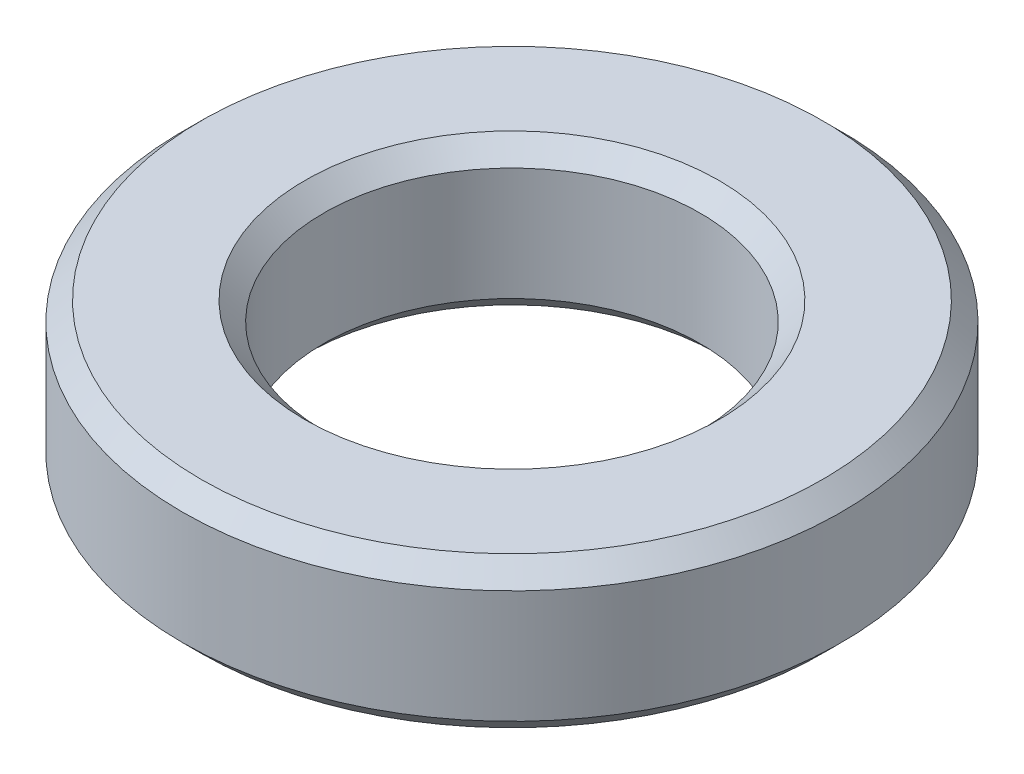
SolidWorks part; units mm, degrees
ref_plane "Face" through (0, 0, 0) normal (0, 0, 1) x (1, 0, 0)
ref_plane "Dessus" through (0, 0, 0) normal (0, 1, 0) x (1, 0, 0)
ref_plane "Droite" through (0, 0, 0) normal (1, 0, 0) x (0, 0, -1)
sketch "Esquisse1" plane through (0, 0, 0) normal (0, 1, 0) x (1, 0, 0)
  circle A0 centre (0, 0) radius 3.5
  circle A1 centre (0, 0) radius 2
  dimension "D1" = 4
  dimension "D2" = 7
extrude "Base-Extrusion" add sketch "Esquisse1" along normal blind 1.6
chamfer "Chanfrein1" distance 0.2 angle 45 4 edges at (0, 0, 3.5) (0, 1.6, 3.5) (0, 0, 2) (0, 1.6, 2)
